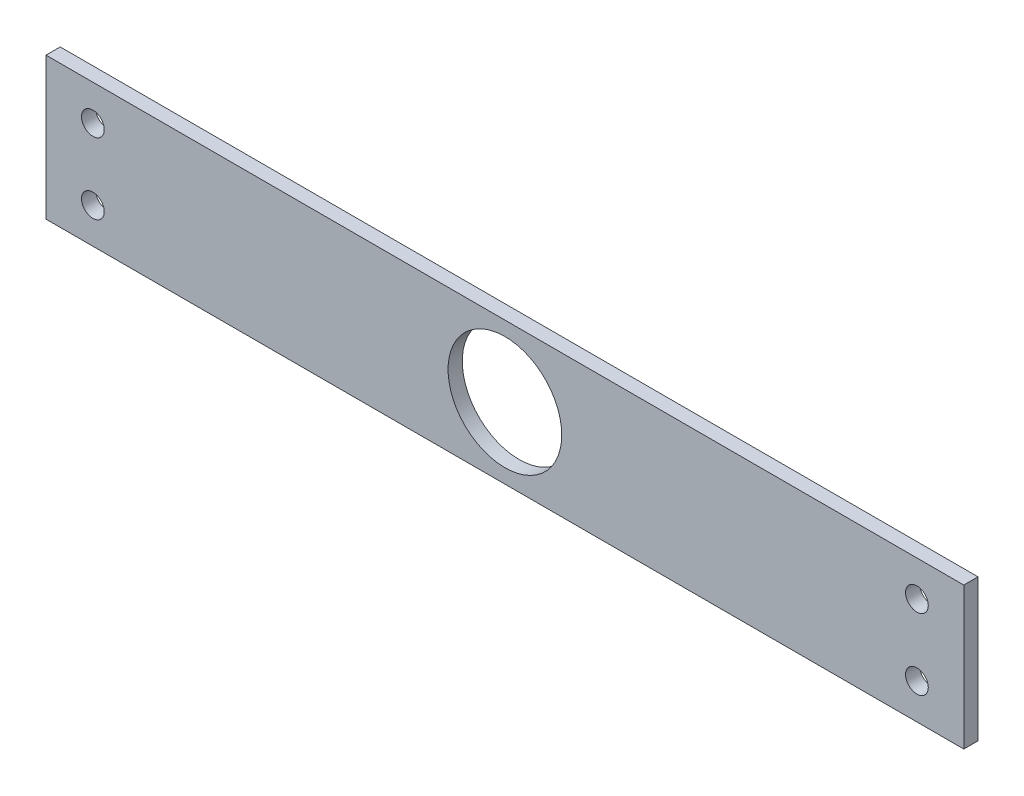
SolidWorks part; units mm, degrees
ref_plane "Plan de face" through (0, 0, 0) normal (0, 0, 1) x (1, 0, 0)
ref_plane "Plan de dessus" through (0, 0, 0) normal (0, 1, 0) x (1, 0, 0)
ref_plane "Plan de droite" through (0, 0, 0) normal (1, 0, 0) x (0, 0, -1)
sketch "Esquisse1" plane through (0, 0, 0) normal (0, 0, 1) x (1, 0, 0)
  line L0 (0, 25) -> (323, 25) construction
  line L1 (0, 0) -> (323, 0)
  line L2 (0, 0) -> (0, 50)
  line L3 (0, 50) -> (323, 50)
  line L4 (323, 0) -> (323, 50)
  line L6 (16.5, 37.5) -> (306.5, 37.5) construction
  line L7 (16.5, 37.5) -> (16.5, 12.5) construction
  line L8 (16.5, 12.5) -> (306.5, 12.5) construction
  line L9 (306.5, 37.5) -> (306.5, 12.5) construction
  line L10 (16.5, 37.5) -> (306.5, 12.5) construction
  line L11 (16.5, 12.5) -> (306.5, 37.5) construction
  circle A0 centre (161.5, 25) radius 20
  circle A1 centre (16.5, 37.5) radius 4
  circle A2 centre (16.5, 12.5) radius 4
  circle A3 centre (306.5, 12.5) radius 4
  circle A4 centre (306.5, 37.5) radius 4
  dimension "D3" = 40
  dimension "D6" = 8
  dimension "D1" = 50
  dimension "D2" = 323
  dimension "D4" = 290
  dimension "D5" = 25
extrude "Boss.-Extru.1" add sketch "Esquisse1" along normal blind 5
